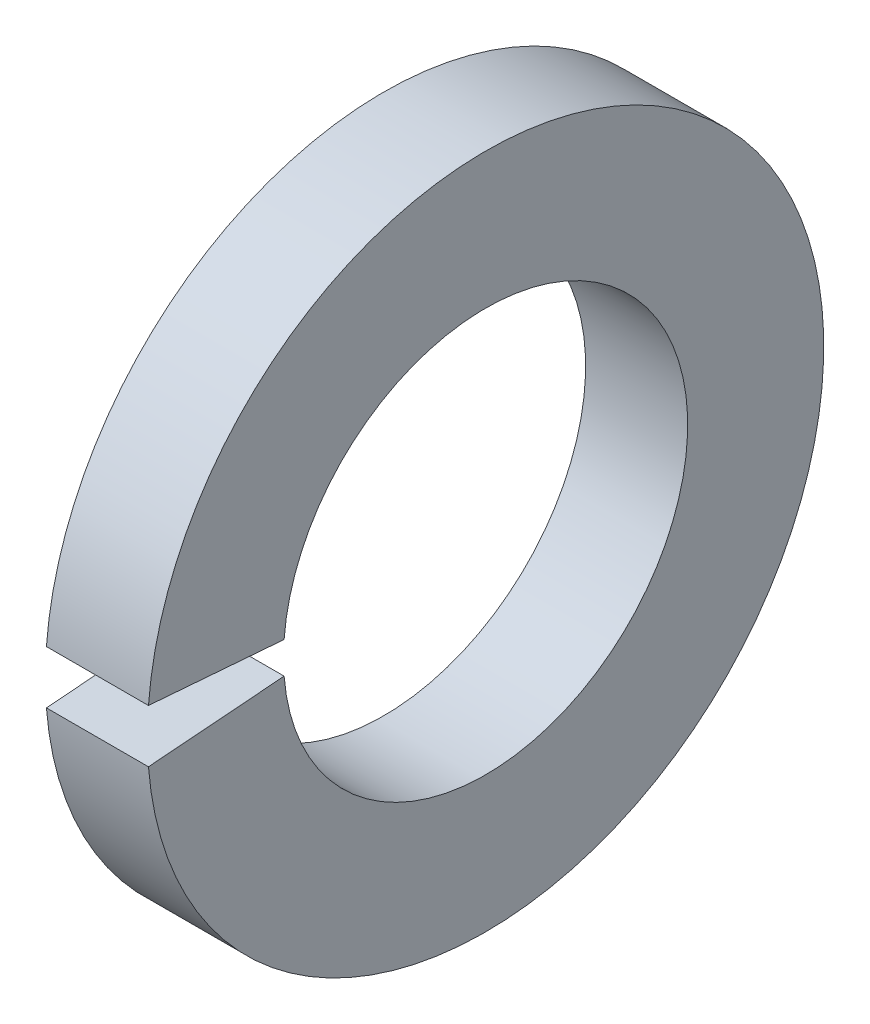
SolidWorks part; units mm, degrees
ref_plane "Plane1" through (0, 0, 0) normal (0, 0, 1) x (1, 0, 0)
ref_plane "Plane2" through (0, 0, 0) normal (0, 1, 0) x (1, 0, 0)
ref_plane "Plane3" through (0, 0, 0) normal (1, 0, 0) x (0, 0, -1)
sketch "Sketch1" plane through (0, 0, 0) normal (0, 0, 1) x (1, 0, 0)
  line L0 (-34.925, 0) -> (9.525, 0) construction
  line L1 (0, 10.1) -> (0, 16.9)
  line L2 (0, 16.9) -> (-5.1, 16.9)
  line L3 (-5.1, 16.9) -> (-5.1, 10.1)
  line L4 (-5.1, 10.1) -> (0, 10.1)
  dimension "Thickness" = 5.1
  dimension "Inside_dia" = 20.2
  dimension "Outside_dia" = 33.8
revolve "Base-Revolve" add sketch "Sketch1" angle 360 about L0
sketch "Sketch2" plane through (0, 0, 0) normal (-1, 0, 0) x (0, -1, 0)
  line L0 (0, 0) -> (1.3525, 17.1849)
  line L1 (0, -3.175) -> (0, 12.7) construction
  line L2 (0, 0) -> (-1.3525, 17.1849)
  arc A0 (1.3525, 17.1849) -> (-1.3525, 17.1849) centre (0, 0) ccw
  dimension "D1" = 17.238
  dimension "Gap_ang" = 9
extrude "Gap" cut sketch "Sketch2" along normal through all
equation "\"D1@Sketch2\" = \"Outside_dia@Sketch1\" * 0.51"
